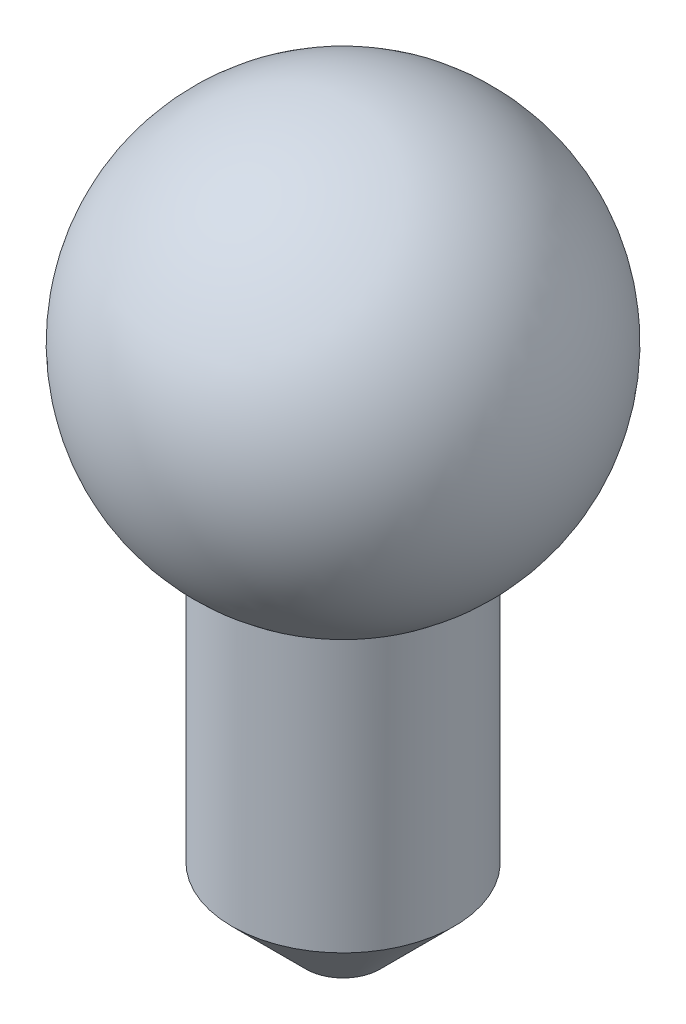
SolidWorks part; units mm, degrees
ref_plane "Plan de face" through (0, 0, 0) normal (0, 0, 1) x (1, 0, 0)
ref_plane "Plan de dessus" through (0, 0, 0) normal (0, 1, 0) x (1, 0, 0)
ref_plane "Plan de droite" through (0, 0, 0) normal (1, 0, 0) x (0, 0, -1)
sketch "Esquisse1" plane through (0, 0, 0) normal (0, 0, 1) x (1, 0, 0)
  line L0 (0, 0) -> (-4.5, 0)
  line L1 (-4.5, 0) -> (-4.5, -11)
  line L2 (-4.5, -11) -> (-1.5, -14)
  line L3 (-1.5, -14) -> (0, -14)
  line L4 (0, -72.482) -> (0, 93.1333) construction
  line L5 (0, 15.7111) -> (0, -14)
  arc A0 (-4.5, 0) -> (0, 15.7111) centre (0, 7.2111) cw
  dimension "D1" = 8.5
  dimension "D2" = 11
  dimension "D3" = 1.5
  dimension "D4" = 3
  dimension "D5" = 3
  dimension "D6" = 4.5
revolve "Révolution4" add sketch "Esquisse1" angle 360 about L4
